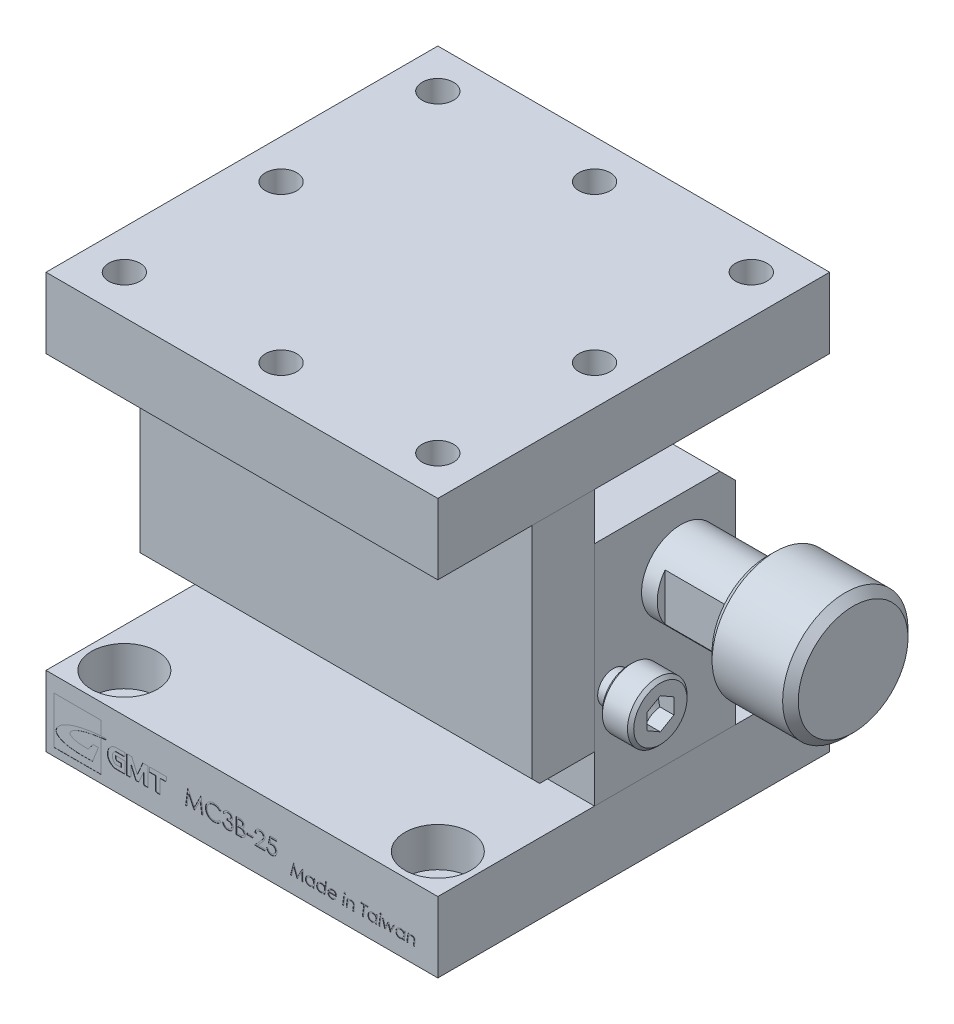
SolidWorks part; units mm, degrees
ref_plane "Front" through (0, 0, 0) normal (0, 0, 1) x (1, 0, 0)
ref_plane "Top" through (0, 0, 0) normal (0, 1, 0) x (1, 0, 0)
ref_plane "Right" through (0, 0, 0) normal (1, 0, 0) x (0, 0, -1)
ref_plane "Plane1" through (0, 22, 0) normal (0, 1, 0) x (-1, 0, 0)
ref_plane "Plane2" through (0, 14.8, 0) normal (0, 1, 0) x (-1, 0, 0)
ref_plane "Plane3" through (0, 10.5, 0) normal (0, 1, 0) x (-1, 0, 0)
ref_plane "Plane4" through (-2.5, 0, 0) normal (1, 0, 0) x (0, 0, -1)
ref_plane "Plane5" through (-5.5, 0, 0) normal (1, 0, 0) x (0, 0, -1)
sketch "Sketch1" plane through (0, 0, 0) normal (0, 0, 1) x (1, 0, 0)
  line L0 (50, 0) -> (-50, 0) construction
  line L1 (-25, 4.5) -> (0, 4.5)
  line L2 (-25, 4.5) -> (-25, 0)
  line L3 (-25, 0) -> (0, 0)
  line L4 (0, 4.5) -> (0, 0)
  line L5 (0, -50) -> (0, 50) construction
  dimension "L" = 25
  dimension "T" = 4.5
extrude "Extrude1" add sketch "Sketch1" along normal mid plane 25
sketch "Sketch2" plane through (0, 22, 0) normal (0, 1, 0) x (-1, 0, 0)
  line L0 (0, -12.5) -> (25, -12.5) construction
  line L1 (0, 12.5) -> (25, 12.5)
  line L2 (0, 12.5) -> (0, -12.5)
  line L3 (0, -12.5) -> (25, -12.5)
  line L4 (25, 12.5) -> (25, -12.5)
  line L5 (0, 12.5) -> (0, -12.5) construction
  line L6 (0, 12.5) -> (25, 12.5) construction
  line L7 (25, 12.5) -> (25, -12.5) construction
extrude "Extrude2" add sketch "Sketch2" along normal blind 4.5
sketch "Sketch3" plane through (0, 0, 0) normal (1, 0, 0) x (0, 0, -1)
  line L0 (-12.5, 4.5) -> (12.5, 4.5) construction
  line L1 (-2.5, 19) -> (6.5, 19)
  line L2 (-2.5, 19) -> (-2.5, 4.5)
  line L3 (-2.5, 4.5) -> (6.5, 4.5)
  line L4 (6.5, 19) -> (6.5, 4.5)
  line L5 (-12.5, 22) -> (12.5, 22) construction
  line L6 (12.5, 0) -> (12.5, 4.5) construction
  dimension "D1" = 3
  dimension "D2" = 6
  dimension "D3" = 9
extrude "Extrude3" add sketch "Sketch3" against normal up to surface (25 mm away) separate body
sketch "Sketch4" plane through (0, 0, 0) normal (1, 0, 0) x (0, 0, -1)
  line L0 (-12.5, 4.5) -> (12.5, 4.5) construction
  line L1 (-6.5, 22) -> (-2.5, 22)
  line L2 (-6.5, 22) -> (-6.5, 7.5)
  line L3 (-6.5, 7.5) -> (-2.5, 7.5)
  line L4 (-2.5, 22) -> (-2.5, 7.5)
  line L5 (-12.5, 22) -> (12.5, 22) construction
  line L6 (-2.5, 19) -> (-2.5, 4.5) construction
  dimension "D1" = 3
  dimension "D2" = 4
extrude "Extrude4" add sketch "Sketch4" against normal up to surface (25 mm away) separate body
sketch "Sketch5" plane through (0, 14.8, 0) normal (0, 1, 0) x (-1, 0, 0)
  line L0 (-25.7654, -3) -> (-3.9182, -3) construction
  line L2 (-11, -3) -> (-11, 1)
  line L3 (-11, 1) -> (-5.5, 1)
  line L4 (-5.5, 1) -> (-5.5, -0.2)
  line L5 (-5.5, -0.2) -> (-5.4, -0.2)
  line L6 (-5.4, -0.2) -> (-5.4, -1)
  line L7 (-5.4, -1) -> (-5, -1)
  line L8 (-5, -1) -> (-5, -0.5)
  line L9 (0, -12.5) -> (25, -12.5) construction
  line L10 (-5, -0.5) -> (0, -0.5)
  line L12 (0, -0.5) -> (0, -3)
  line L13 (0, -3) -> (-11, -3)
  line L14 (0, 12.5) -> (0, -12.5) construction
  dimension "D1" = 9.5
  dimension "D2" = 8
  dimension "D3" = 11
  dimension "D4" = 5.5
  dimension "D5" = 5.6
  dimension "D6" = 4
  dimension "D7" = 5.6
  dimension "D8" = 6
  dimension "D9" = 5
revolve "Revolve1" add sketch "Sketch5" angle 360 about L0
sketch "Sketch6" plane through (0, 10.5, 0) normal (0, 1, 0) x (-1, 0, 0)
  line L0 (-17.8347, 1.3) -> (6.1932, 1.3) construction
  line L2 (0, -12.5) -> (25, -12.5) construction
  line L3 (0, 1.3) -> (-3, 1.3)
  line L4 (0, 12.5) -> (0, -12.5) construction
  line L5 (-3, 1.3) -> (-3, 3.2)
  line L6 (-3, 3.2) -> (-1, 3.2)
  line L7 (-1, 3.2) -> (-1, 2.3)
  line L8 (-1, 2.3) -> (0, 2.3)
  line L9 (0, 2.3) -> (0, 1.3)
  dimension "D1" = 13.8
  dimension "D2" = 3.8
  dimension "D3" = 3
  dimension "D4" = 2
  dimension "D5" = 2
revolve "Revolve3" add sketch "Sketch6" angle 360 about L0
sketch "Sketch7" plane through (-2.5, 0, 0) normal (1, 0, 0) x (0, 0, -1)
  line L0 (10, 33.1571) -> (10, 20.256) construction
  line L1 (12.5, 26.5) -> (12.5, 22) construction
  line L2 (-12.5, 26.5) -> (12.5, 26.5) construction
  line L3 (10, 26.5) -> (11, 26.5)
  line L4 (10, 26.5) -> (10, 22)
  line L5 (10, 22) -> (11, 22)
  line L6 (11, 26.5) -> (11, 22)
  line L7 (-12.5, 22) -> (12.5, 22) construction
  dimension "D1" = 2.5
  dimension "D2" = 2
revolve "Cut-Revolve1" cut sketch "Sketch7" angle 360 about L0
pattern_linear "LPattern1" count 3 spacing 10 along (0, 0, 1) count 3 spacing 10 along (-1, 0, 0) of "Cut-Revolve1"
sketch "Sketch8" plane through (-2.5, 0, 0) normal (1, 0, 0) x (0, 0, -1)
  line L0 (10, 13.0235) -> (10, -1.1702) construction
  line L1 (-12.5, 0) -> (12.5, 0) construction
  line L2 (10, 4.5) -> (11.25, 4.5)
  line L3 (10, 4.5) -> (10, 0)
  line L4 (10, 0) -> (11.25, 0)
  line L5 (11.25, 4.5) -> (11.25, 0)
  line L6 (-12.5, 4.5) -> (12.5, 4.5) construction
  line L7 (12.5, 0) -> (12.5, 4.5) construction
  dimension "D1" = 2.5
  dimension "D2" = 2.5
revolve "Cut-Revolve2" cut sketch "Sketch8" angle 360 about L0
sketch "Sketch9" plane through (-2.5, 0, 0) normal (1, 0, 0) x (0, 0, -1)
  line L1 (10, 13.0235) -> (10, -1.1702) construction
  line L2 (-12.5, 0) -> (12.5, 0) construction
  line L3 (10, 4.5) -> (12.1, 4.5)
  line L4 (10, 4.5) -> (10, 2)
  line L5 (10, 2) -> (12.1, 2)
  line L6 (12.1, 4.5) -> (12.1, 2)
  line L7 (-12.5, 4.5) -> (12.5, 4.5) construction
  line L8 (12.5, 0) -> (12.5, 4.5) construction
  dimension "D1" = 2
  dimension "D2" = 4.2
  dimension "D3" = 2.5
revolve "Cut-Revolve3" cut sketch "Sketch9" angle 360 about L1
pattern_linear "LPattern2" count 2 spacing 20 along (-1, 0, 0) count 2 spacing 20 along (0, 0, 1) of "Cut-Revolve2"
pattern_linear "LPattern4" count 2 spacing 20 along (-1, 0, 0) count 2 spacing 20 along (0, 0, 1) of "Cut-Revolve3"
sketch "Sketch10" plane through (0, 14.8, 0) normal (0, 1, 0) x (1, 0, 0)
  line L0 (11, 3) -> (1.69, 3) construction
  line L1 (1, 1) -> (5, 1)
  line L2 (1, 1) -> (1, 0.5)
  line L3 (1, 0.5) -> (5, 0.5)
  line L4 (5, 1) -> (5, 0.5)
  line L5 (11, -1) -> (11, 7) construction
  line L6 (5, 0.5) -> (5, 5.5) construction
  line L7 (0, 0.5) -> (5, 0.5) construction
  line L8 (5, 5) -> (5, 5.5)
  line L9 (1, 5.5) -> (5, 5.5)
  line L10 (1, 5) -> (1, 5.5)
  line L11 (1, 5) -> (5, 5)
  dimension "D1" = 4
  dimension "D2" = 0.5
extrude "Cut-Extrude1" cut sketch "Sketch10" along normal mid plane 10
sketch "Sketch11" plane through (-5.5, 0, 0) normal (1, 0, 0) x (0, 0, -1)
  line L0 (-12.5, 22) -> (12.5, 22) construction
  line L1 (-2.5, 22) -> (0, 22)
  line L2 (-2.5, 22) -> (-2.5, 19)
  line L3 (-2.5, 19) -> (0, 19)
  line L4 (0, 22) -> (0, 19)
  line L5 (-2.5, 7.5) -> (-2.5, 22) construction
  line L6 (6.5, 19) -> (-2.5, 19) construction
  dimension "D1" = 2.5
extrude "Extrude5" add sketch "Sketch11" against normal blind 14.5 separate body
sketch "Sketch12" plane through (0, 10.5, 0) normal (0, 1, 0) x (-1, 0, 0)
  line L0 (-4.6691, 1.3) -> (-3, 1.3) construction
  line L1 (-3, 3.2) -> (-3, -0.6) construction
  line L2 (-3, 2.15) -> (-2.0107, 2.15)
  line L3 (-2.0107, 2.15) -> (-1.5, 1.3)
  line L4 (-1.5, 1.3) -> (-3, 1.3)
  line L5 (-3, 1.3) -> (-3, 2.15)
  dimension "D1" = 1.5
  dimension "D2" = 1.7
  dimension "D3" = 59
revolve "Cut-Revolve4" cut sketch "Sketch12" angle 360 about L0
sketch "Sketch13" plane through (3, 0, 0) normal (1, 0, 0) x (0, 0, -1)
  line L0 (-1.3, 10.5) -> (-1.3, 11.9456) construction
  line L1 (-1.3, 11.5) -> (-2.166, 11)
  line L2 (-2.166, 11) -> (-2.166, 10)
  line L3 (-2.166, 10) -> (-1.3, 9.5)
  line L4 (-1.3, 9.5) -> (-0.434, 10)
  line L5 (-0.434, 10) -> (-0.434, 11)
  line L6 (-0.434, 11) -> (-1.3, 11.5)
  circle A0 centre (-1.3, 10.5) radius 1 construction
  dimension "D1" = 2
  dimension "D2" = 120
extrude "Cut-Extrude2" cut sketch "Sketch13" against normal up to surface (0.8991 mm away)
chamfer "Chamfer3" distance 0.5 angle 45 2 edges at (5.5, 14.8, -7) (11, 14.8, -7)
chamfer "Chamfer4" distance 0.5 angle 45 1 edges at (-12.5, 7.5, 6.5)
chamfer "Chamfer6" distance 0.2 angle 45 2 edges at (1, 10.5, -0.6) (3, 10.5, -0.6)
chamfer "Chamfer8" distance 1 angle 45 1 edges at (-12.5, 19, -6.5)
sketch "Sketch35" plane through (0, 14.8, 0) normal (0, 1, 0) x (-1, 0, 0)
  line L0 (-5.4, -5) -> (-5.4, -1) construction
  line L1 (-5.5, -0.2) -> (-5.4, -0.2)
  line L2 (-5.5, -0.2) -> (-5.5, -1)
  line L3 (-5.5, -1) -> (-5.4, -1)
  line L4 (-5.4, -0.2) -> (-5.4, -1)
  line L5 (-11, -3) -> (-2.518, -3) construction
  line L6 (-11, 0.5) -> (-11, -6.5) construction
  line L9 (-5, -1) -> (-5.4, -1) construction
revolve "Cut-Revolve10" cut sketch "Sketch35" angle 360 about L5
sketch "草圖2" plane through (0, 0, 12.5) normal (0, 0, 1) x (1, 0, 0)
  line L0 (-24.5, 3.5022) -> (-24.5, 0.5)
  line L1 (-24.5, 0.5) -> (-21.5009, 0.5)
  line L2 (-21.5009, 0.5) -> (-21.5009, 2.5209)
  line L3 (-21.5009, 2.6134) -> (-21.5009, 3.5022)
  line L4 (-17.7147, 2.1637) -> (-17.7147, 1.2703)
  line L5 (-17.7147, 2.1637) -> (-17.4157, 2.1637)
  line L6 (-17.3219, 2.2575) -> (-17.3219, 2.4667)
  line L7 (-17.3219, 2.4667) -> (-18.4051, 2.4667)
  line L8 (-18.4051, 2.4667) -> (-18.4051, 2.1693)
  line L9 (-18.4051, 2.1693) -> (-18.0173, 2.1693)
  line L10 (-18.0173, 2.1693) -> (-18.0173, 1.3658)
  line L11 (-17.9243, 1.272) -> (-17.7147, 1.2703)
  line L12 (-18.4864, 2.4667) -> (-18.8258, 2.4667)
  line L13 (-19.5271, 2.4667) -> (-19.8661, 2.4667)
  line L14 (-19.9441, 2.4667) -> (-20.5762, 2.4667)
  line L15 (-19.8661, 2.4667) -> (-19.8661, 1.2727)
  line L16 (-18.4868, 1.2727) -> (-18.6883, 1.2727)
  line L17 (-19.0888, 1.2727) -> (-19.2642, 1.2727)
  line L18 (-19.6646, 1.2727) -> (-19.8661, 1.2727)
  line L19 (-19.9506, 1.2727) -> (-20.5762, 1.2727)
  line L20 (-19.5271, 2.4667) -> (-19.1765, 1.6536)
  line L21 (-19.5708, 1.967) -> (-19.5708, 1.3665)
  line L22 (-19.5708, 1.967) -> (-19.2642, 1.2727)
  line L23 (-18.4868, 2.4667) -> (-18.4868, 1.2727)
  line L24 (-18.7822, 1.967) -> (-18.7822, 1.3665)
  line L25 (-18.7822, 1.967) -> (-19.0888, 1.2727)
  line L26 (-18.8258, 2.4667) -> (-19.1765, 1.6536)
  line L27 (-19.9506, 2.008) -> (-20.5539, 2.008)
  line L28 (-19.9506, 2.008) -> (-19.9506, 1.2727)
  line L29 (-20.5539, 2.008) -> (-20.5539, 1.8471)
  line L30 (-20.2104, 1.7533) -> (-20.4601, 1.7533)
  line L31 (-20.2104, 1.7533) -> (-20.2104, 1.5249)
  line L32 (-20.2104, 1.5249) -> (-20.5762, 1.5249)
  line L33 (-19.9441, 2.4667) -> (-19.9441, 2.3175)
  line L34 (-20.5762, 2.2237) -> (-20.0379, 2.2237)
  line L35 (-22.0424, 0.9392) -> (-21.6668, 1.8936)
  line L36 (-21.6668, 1.8936) -> (-22.0052, 1.8933)
  line L37 (-22.0052, 1.8933) -> (-22.3224, 1.4856)
  line L38 (-21.1737, 2.6472) -> (-21.1737, 2.5605)
  line L39 (-22.0424, 0.9392) -> (-22.9312, 0.9344)
  line L40 (-24.5, 3.5022) -> (-21.5009, 3.5022)
  arc A0 (-17.4157, 2.1637) -> (-17.3219, 2.2575) centre (-17.4157, 2.2575) ccw
  arc A1 (-18.0173, 1.3658) -> (-17.9243, 1.272) centre (-17.9235, 1.3658) ccw
  arc A2 (-19.6646, 1.2727) -> (-19.5708, 1.3665) centre (-19.6646, 1.3665) ccw
  arc A3 (-18.7822, 1.3665) -> (-18.6883, 1.2727) centre (-18.6883, 1.3665) ccw
  arc A4 (-20.5539, 1.8471) -> (-20.4601, 1.7533) centre (-20.4601, 1.8471) ccw
  arc A5 (-20.0379, 2.2237) -> (-19.9441, 2.3175) centre (-20.0379, 2.3175) ccw
  arc A6 (-20.5762, 2.2237) -> (-20.5762, 1.5249) centre (-20.3582, 1.8743) ccw
  arc A7 (-20.5762, 2.4667) -> (-20.5762, 1.2727) centre (-20.4743, 1.8697) ccw
  arc A8 (-22.7633, 1.5021) -> (-22.3224, 1.4856) centre (-22.3692, 6.1485) ccw
  arc A9 (-23.1242, 1.5502) -> (-22.7633, 1.5021) centre (-22.7459, 3.0102) ccw
  arc A10 (-23.4049, 1.6651) -> (-23.1242, 1.5502) centre (-22.9891, 2.2805) ccw
  arc A11 (-23.4755, 1.7877) -> (-23.4049, 1.6651) centre (-23.3346, 1.7872) ccw
  arc A12 (-23.431, 1.8891) -> (-23.4755, 1.7877) centre (-23.2829, 1.7636) ccw
  arc A13 (-23.28, 2.0231) -> (-23.431, 1.8891) centre (-22.9417, 1.4899) ccw
  arc A14 (-23.076, 2.1342) -> (-23.28, 2.0231) centre (-22.4121, 0.6725) ccw
  arc A15 (-23.076, 2.1342) -> (-22.8227, 2.2341) centre (-24.9991, 7.3827) ccw
  arc A16 (-22.8227, 2.2341) -> (-22.5958, 2.3018) centre (-28.1753, 20.5863) ccw
  arc A17 (-22.3707, 2.3609) -> (-22.5958, 2.3018) centre (-22.1656, 1.1209) ccw
  arc A18 (-22.3707, 2.3609) -> (-22.1821, 2.4003) centre (-22.5916, 3.8896) ccw
  arc A19 (-21.941, 2.4468) -> (-22.1821, 2.4003) centre (-20.6715, -4.7725) ccw
  arc A20 (-21.941, 2.4468) -> (-21.7131, 2.4876) centre (-22.158, 4.3167) ccw
  arc A21 (-21.7131, 2.4876) -> (-21.5105, 2.5186) centre (-21.7908, 3.6749) ccw
  arc A22 (-21.3249, 2.5442) -> (-21.5105, 2.5186) centre (-19.3395, -12.5263) ccw
  arc A23 (-21.1737, 2.5605) -> (-21.3249, 2.5442) centre (-21.1335, 1.4791) ccw
  arc A24 (-22.9312, 0.9344) -> (-23.2293, 0.9606) centre (-25.5759, -27.4168) ccw
  arc A25 (-23.5618, 1.0031) -> (-23.2293, 0.9606) centre (-22.7883, 5.7375) ccw
  arc A26 (-23.9993, 1.116) -> (-23.5618, 1.0031) centre (-23.0783, 3.7803) ccw
  arc A27 (-24.2946, 1.3058) -> (-23.9993, 1.116) centre (-23.6581, 1.9717) ccw
  arc A28 (-24.3706, 1.485) -> (-24.2946, 1.3058) centre (-24.1324, 1.4802) ccw
  arc A29 (-24.2735, 1.7191) -> (-24.3706, 1.485) centre (-23.9616, 1.4526) ccw
  arc A30 (-24.0457, 1.9426) -> (-24.2735, 1.7191) centre (-23.3184, 0.9734) ccw
  arc A31 (-23.7715, 2.0987) -> (-24.0457, 1.9426) centre (-22.2312, -0.9273) ccw
  arc A32 (-23.5098, 2.2173) -> (-23.7715, 2.0987) centre (-22.3887, -0.6041) ccw
  arc A33 (-23.3218, 2.2838) -> (-23.5098, 2.2173) centre (-9.8237, -36.1815) ccw
  arc A34 (-23.0578, 2.36) -> (-23.3218, 2.2838) centre (-22.4992, -0.0708) ccw
  arc A35 (-22.7798, 2.4304) -> (-23.0578, 2.36) centre (-21.9769, -1.3241) ccw
  arc A36 (-22.5193, 2.4807) -> (-22.7798, 2.4304) centre (-21.1392, -5.3604) ccw
  arc A37 (-22.5193, 2.4807) -> (-22.2935, 2.5235) centre (-22.8327, 4.751) ccw
  arc A38 (-22.091, 2.5521) -> (-22.2935, 2.5235) centre (-22.0315, 1.3975) ccw
  arc A39 (-21.855, 2.5799) -> (-22.091, 2.5521) centre (-21.7617, 0.7738) ccw
  arc A40 (-21.6456, 2.6069) -> (-21.855, 2.5799) centre (-21.4775, 0.4815) ccw
  arc A41 (-21.4529, 2.6258) -> (-21.6456, 2.6069) centre (-21.0837, -2.1371) ccw
  arc A42 (-21.5624, 2.6161) -> (-21.3147, 2.6392) centre (-22.9314, 18.5992) ccw
  arc A43 (-21.1737, 2.6472) -> (-21.3147, 2.6392) centre (-21.1892, 1.6734) ccw
extrude "除料-伸長2" cut sketch "草圖2" against normal blind 0.02
sketch "草圖1" plane through (0, 0, 12.5) normal (0, 0, 1) x (1, 0, 0)
  line L1 (-24.5, 0.5) -> (-21.5, 0.5)
  line L2 (-24.5, 0.5) -> (-24.5, 3.5)
  line L3 (-24.5, 3.5) -> (-21.5, 3.5)
  line L4 (-21.5, 0.5) -> (-21.5, 3.5)
  line L6 (-25, 0) -> (0, 0) construction
  line L7 (-25, 4.5) -> (-25, 0) construction
  dimension "D1" = 3
  dimension "D2" = 3
  dimension "D3" = 0.5
  dimension "D4" = 0.5
extrude "除料-伸長1" cut sketch "草圖1" against normal blind 0.01
sketch "草圖3"
  dimension "D1" = 1
  dimension "D2" = 10
extrude "除料-伸長3" cut sketch "草圖3" against normal blind 0.02
sketch "草圖4" plane through (0, 0, 12.5) normal (0, 0, 1) x (1, 0, 0)
  line L0 (-16.1651, 1.5) -> (-10, 1.5) construction
  line L3 (-25, 0) -> (0, 0) construction
  text T0 "MC3B-25" font "Century Gothic" height 1
  point P5 (0, 0)
  dimension "D1" = 10
  dimension "D2" = 1.5
extrude "除料-伸長4" cut sketch "草圖4" against normal blind 0.02
